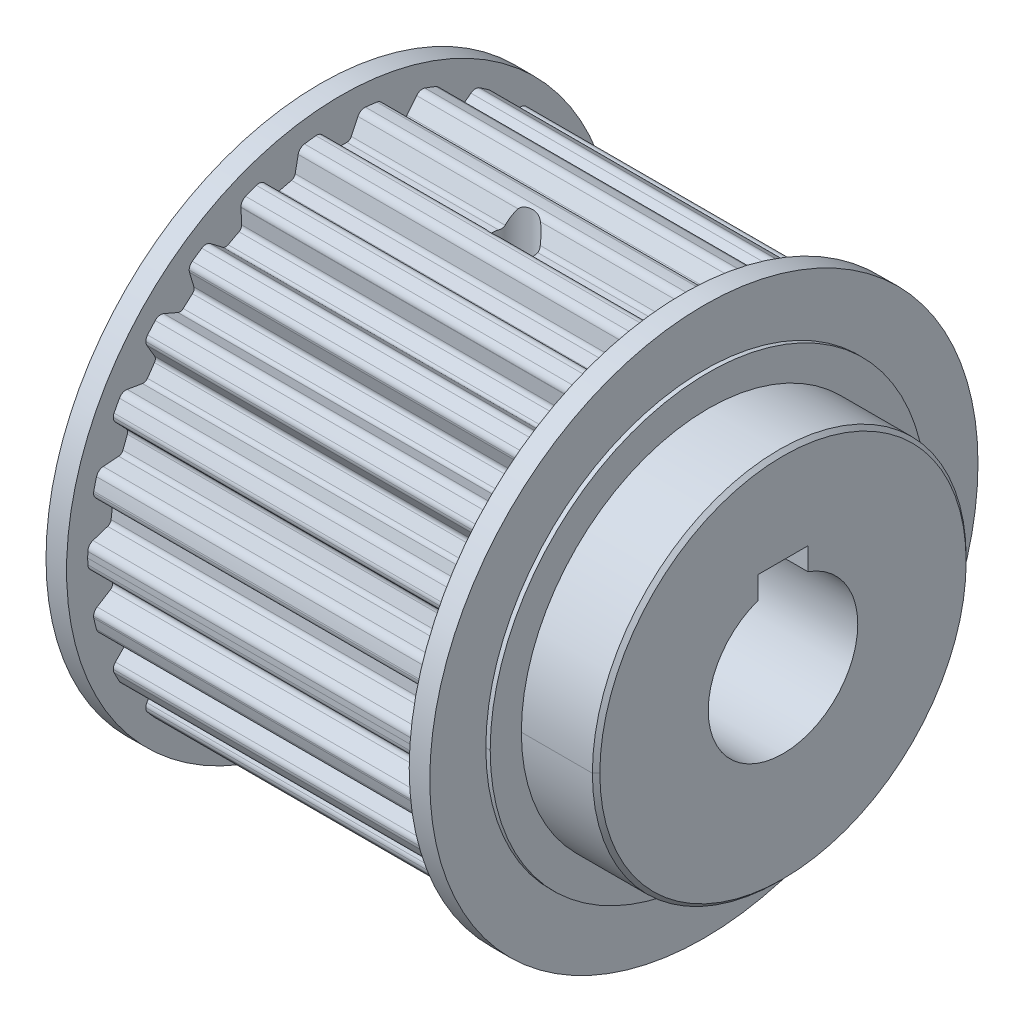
SolidWorks part; units mm, degrees
other "Cut-Extrude4[1]"
ref_plane "Front Plane" through (0, 0, 0) normal (0, 0, 1) x (1, 0, 0)
ref_plane "Top Plane" through (0, 0, 0) normal (0, 1, 0) x (1, 0, 0)
ref_plane "Right Plane" through (0, 0, 0) normal (1, 0, 0) x (0, 0, -1)
imported_body "Imported1"
sketch "Sketch1" plane through (0, 0, 0) normal (-1, 0, 0) x (0, 0, 1)
  circle A0 centre (0, 0) radius 9.532 construction
  text T0 "                                25T5-26D12K4" font "Century Gothic" height 2.5
extrude "Cut-Extrude1" cut sketch "Sketch1" against normal blind 0.5
sketch "Sketch2" plane through (30.15, 0, 0) normal (-1, 0, 0) x (0, 0, 1)
  arc A2 (22, 0) -> (-22, 0) centre (0, 0) ccw
  arc A3 (-22, 0) -> (22, 0) centre (0, 0) ccw
  arc A4 (22, 0) -> (-22, 0) centre (0, 0) ccw
  arc A5 (-22, 0) -> (22, 0) centre (0, 0) ccw
  dimension "D1" = 0
extrude "Boss-Extrude1" add sketch "Sketch2" along normal blind 0.65
sketch "Sketch3" plane through (1.35, 0, 0) normal (1, 0, 0) x (0, 0, -1)
  arc A2 (22, 0) -> (-22, 0) centre (0, 0) ccw
  arc A3 (-22, 0) -> (22, 0) centre (0, 0) ccw
  arc A4 (22, 0) -> (-22, 0) centre (0, 0) ccw
  arc A5 (-22, 0) -> (22, 0) centre (0, 0) ccw
  dimension "D1" = 0
extrude "Boss-Extrude2" add sketch "Sketch3" along normal blind 0.65
sketch "Sketch4" plane through (30.15, 0, 0) normal (1, 0, 0) x (0, 0, -1)
  line L3 (2, 5.6569) -> (2, 7.4569)
  line L4 (2, 7.4569) -> (-2, 7.4569)
  line L5 (-2, 7.4569) -> (-2, 5.6569)
  line L6 (2, 5.6569) -> (2, 7.4569)
  line L7 (2, 7.4569) -> (-2, 7.4569)
  line L8 (-2, 7.4569) -> (-2, 5.6569)
  arc A3 (6, 0) -> (2, 5.6569) centre (0, 0) ccw
  arc A4 (-2, 5.6569) -> (-6, 0) centre (0, 0) ccw
  arc A5 (-6, 0) -> (6, 0) centre (0, 0) ccw
  arc A6 (6, 0) -> (2, 5.6569) centre (0, 0) ccw
  arc A7 (-2, 5.6569) -> (-6, 0) centre (0, 0) ccw
  arc A8 (-6, 0) -> (6, 0) centre (0, 0) ccw
  dimension "D1" = 0
extrude "Cut-Extrude2" cut sketch "Sketch4" against normal up to surface (30.15 mm away)
hole_wizard "M4 Tapped Hole1" positions "Sketch5" profile "Sketch6" tap size "M4" standard "DIN"
sketch "Sketch5" plane through (0, 7.4569, 0) normal (0, -1, 0) x (-1, 0, 0)
  line L0 (0, 2) -> (0, -2) construction
  point P0 (-15.75, 0)
  dimension "D1" = 15.75
sketch "Sketch6" plane through (15.75, 7.4569, 0) normal (1, 0, 0) x (0, 0, -1)
  line L0 (0, 0) -> (0, 14.9914)
  line L1 (0, 14.9914) -> (1.65, 14)
  line L2 (1.65, 14) -> (1.65, 0.375)
  line L3 (1.65, 0.375) -> (2.025, 0)
  line L5 (2.025, 0) -> (0, 0)
  line L6 (-1.65, 0.375) -> (-2.025, 0) construction
  line L10 (0, 14.9914) -> (-1.65, 14) construction
  line L11 (0, -6.35) -> (0, 107.95) construction
  dimension "Tap Drill Dia." = 3.3
  dimension "Tap Drill Depth" = 14
  dimension "Near C'Sink Dia." = 4.05
  dimension "Near C'Sink Angle" = 90
  dimension "Drill Angle" = 118
